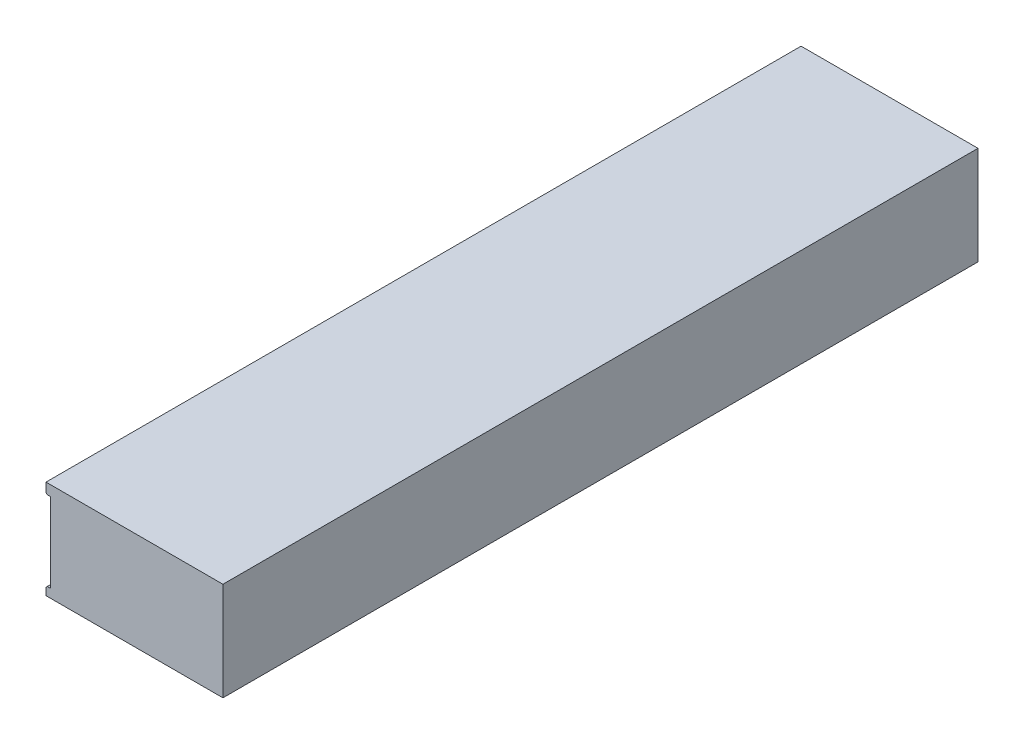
SolidWorks part; units mm, degrees
ref_plane "FRONT" through (0, 0, 0) normal (0, 0, 1) x (1, 0, 0)
ref_plane "TOP" through (0, 0, 0) normal (0, 1, 0) x (1, 0, 0)
ref_plane "RIGHT" through (0, 0, 0) normal (1, 0, 0) x (0, 0, -1)
sketch "Sketch1" plane through (0, 0, 0) normal (0, 0, 1) x (1, 0, 0)
  line L0 (50.673, 0) -> (50.673, -28.956)
  line L1 (50.673, -28.956) -> (-1.397, -28.956)
  line L2 (-1.397, -28.956) -> (-1.397, -26.416)
  line L3 (-1.397, -26.416) -> (0, -26.416)
  line L4 (0, -26.416) -> (0, -3.048)
  line L5 (0, -3.048) -> (-1.397, -3.048)
  line L6 (-1.397, -3.048) -> (-1.397, 0)
  line L7 (-1.397, 0) -> (50.673, 0)
  dimension "D1" = 52.07
  dimension "D2" = 50.673
  dimension "D3" = 3.048
  dimension "D4" = 2.54
  dimension "D5" = 28.956
extrude "Extrude1" add sketch "Sketch1" along normal mid plane 222.2246
sketch "Sketch2" plane through (0, 0, 0) normal (-1, 0, 0) x (0, 0, 1)
  line L1 (0, 0) -> (0, -28.956) construction
  line L2 (111.1123, -28.956) -> (-111.1123, -28.956) construction
  line L3 (0, -14.478) -> (26.0126, -14.478) construction
  point P0 (-106.2482, -6.35)
  point P1 (106.2482, -6.35)
  point P2 (4.8768, -6.35)
  point P4 (-4.8768, -6.35)
  point P9 (-4.8768, -23.114)
  point P12 (4.8768, -23.114)
  point P13 (106.2482, -23.114)
  point P14 (50.673, -6.35)
  point P15 (60.4266, -6.35)
  point P16 (-50.673, -23.114)
  point P17 (-60.4266, -6.35)
  point P18 (-106.2482, -23.114)
  point P19 (-50.673, -6.35)
  point P20 (-60.4266, -23.114)
  point P21 (50.673, -23.114)
  point P22 (60.4266, -23.114)
  dimension "D1" = 106.2482
  dimension "D2" = 60.4266
  dimension "D3" = 4.8768
  dimension "D4" = 8.128
  dimension "D5" = 8.636
  dimension "D6" = 50.673
hole_wizard "#10-32 Tapped Hole1" positions "3DSketch1" profile "Sketch3" tap size "#10-32" standard "Ansi Inch"
sketch3d "3DSketch1"
  point P0 (0, -6.35, -106.2482)
  point P3 (0, -6.35, 106.2482)
  point P6 (0, -6.35, 4.8768)
  point P9 (0, -6.35, -4.8768)
  point P12 (0, -23.114, -106.2482)
  point P15 (0, -23.114, -4.8768)
  point P18 (0, -23.114, 4.8768)
  point P21 (0, -23.114, 106.2482)
  point P24 (0, -6.35, -60.4266)
  point P27 (0, -6.35, -50.673)
  point P30 (0, -23.114, -50.673)
  point P33 (0, -23.114, -60.4266)
  point P36 (0, -6.35, 50.673)
  point P39 (0, -6.35, 60.4266)
  point P42 (0, -23.114, 60.4266)
  point P45 (0, -23.114, 50.673)
sketch "Sketch3" plane through (0, -6.35, -106.2482) normal (0, 1, 0) x (0, 0, 1)
  line L0 (0, 0) -> (0, 11.2108)
  line L1 (0, 11.2108) -> (2.0193, 9.9974)
  line L2 (2.0193, 9.9974) -> (2.0193, 7.62)
  line L3 (2.0193, 7.62) -> (2.413, 7.62)
  line L4 (2.413, 7.62) -> (2.413, 0)
  line L5 (2.413, 0) -> (0, 0)
  line L10 (0, 11.2108) -> (-2.0193, 9.9974) construction
  line L11 (0, -6.35) -> (0, 107.95) construction
  dimension "Tap Drill Dia." = 4.0386
  dimension "Tap Drill Depth" = 9.9974
  dimension "Thread Major Dia." = 4.826
  dimension "Thread Depth" = 7.62
  dimension "Drill Angle" = 118
chamfer "Chamfer1" distance 0.381 angle 45 2 edges at (-1.397, -26.416, 0) (-1.397, -3.048, 0)
